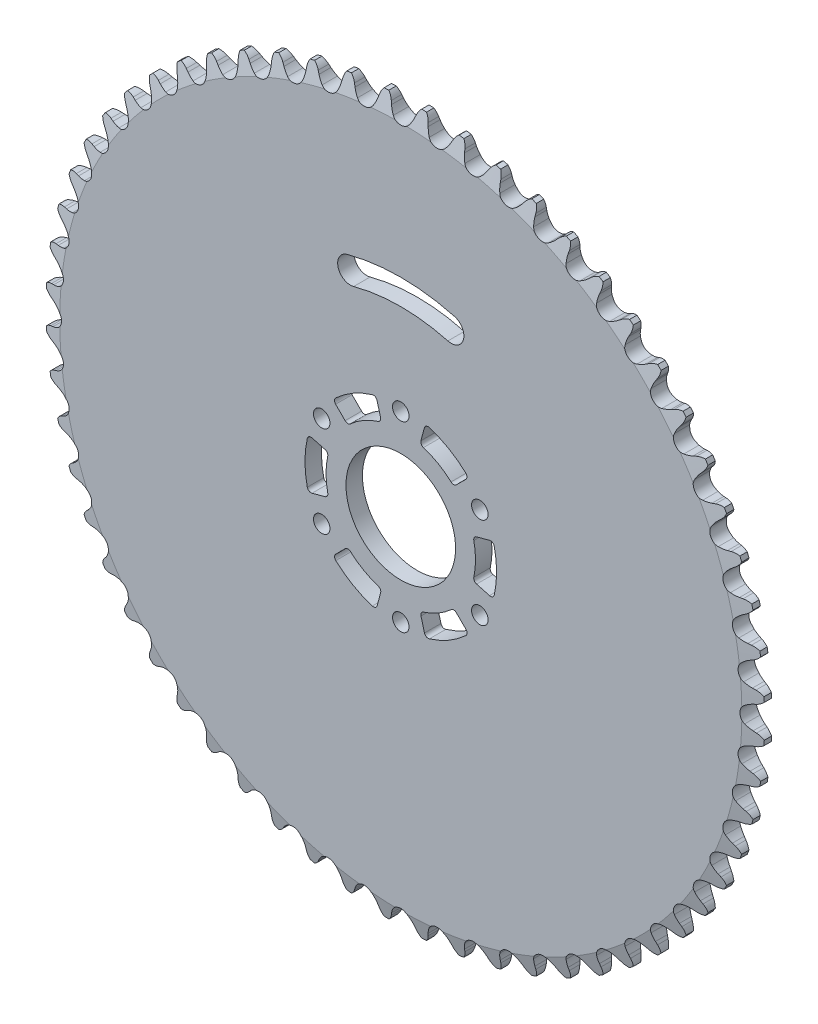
SolidWorks part; units mm, degrees
ref_plane "Front Plane" through (0, 0, 0) normal (0, 0, 1) x (1, 0, 0)
ref_plane "Top Plane" through (0, 0, 0) normal (0, 1, 0) x (1, 0, 0)
ref_plane "Right Plane" through (0, 0, 0) normal (1, 0, 0) x (0, 0, -1)
imported_body "Imported3"
sketch "Sketch1" plane through (0, 0, 2.1463) normal (0, 0, 1) x (1, 0, 0)
  line L0 (-17.7136, 17.6417) -> (-13.8245, 13.7526)
  line L1 (-5.0224, 18.8421) -> (-6.4459, 24.1547)
  arc A0 (-6.4459, 24.1547) -> (-17.7136, 17.6417) centre (0, 0) ccw
  arc A1 (-13.8245, 13.7526) -> (-5.0224, 18.8421) centre (0, 0) cw
extrude "Cut-Extrude1" cut sketch "Sketch1" against normal through all
sketch "Sketch2" plane through (0, 0, 2.1463) normal (0, 0, 1) x (1, 0, 0)
  line L0 (-6.4214, -24.1612) -> (-4.9979, -18.8486)
  line L1 (-13.8065, -13.7706) -> (-17.6956, -17.6597)
  arc A0 (-17.6956, -17.6597) -> (-6.4214, -24.1612) centre (0, 0) ccw
  arc A1 (-4.9979, -18.8486) -> (-13.8065, -13.7706) centre (0, 0) cw
extrude "Cut-Extrude2" cut sketch "Sketch2" against normal through all
sketch "Sketch3" plane through (0, 0, 2.1463) normal (0, 0, 1) x (1, 0, 0)
  line L0 (17.7136, -17.6417) -> (13.8245, -13.7526)
  line L1 (5.0224, -18.8421) -> (6.4459, -24.1547)
  arc A0 (6.4459, -24.1547) -> (17.7136, -17.6417) centre (0, 0) ccw
  arc A1 (13.8245, -13.7526) -> (5.0224, -18.8421) centre (0, 0) cw
extrude "Cut-Extrude3" cut sketch "Sketch3" against normal through all
sketch "Sketch4" plane through (0, 0, 2.1463) normal (0, 0, 1) x (1, 0, 0)
  line L0 (24.1349, 6.5195) -> (18.8223, 5.096)
  line L1 (18.829, -5.0715) -> (24.1416, -6.495)
  arc A0 (24.1416, -6.495) -> (24.1349, 6.5195) centre (0, 0) ccw
  arc A1 (18.8223, 5.096) -> (18.829, -5.0715) centre (0, 0) cw
extrude "Cut-Extrude4" cut sketch "Sketch4" against normal through all
sketch "Sketch5" plane through (0, 0, 2.1463) normal (0, 0, 1) x (1, 0, 0)
  line L0 (6.4214, 24.1612) -> (4.9979, 18.8486)
  line L1 (13.8065, 13.7706) -> (17.6956, 17.6597)
  arc A0 (17.6956, 17.6597) -> (6.4214, 24.1612) centre (0, 0) ccw
  arc A1 (4.9979, 18.8486) -> (13.8065, 13.7706) centre (0, 0) cw
extrude "Cut-Extrude5" cut sketch "Sketch5" against normal through all
sketch "Sketch6" plane through (0, 0, -2.1463) normal (0, 0, -1) x (-1, 0, 0)
  line L0 (24.1416, 6.495) -> (18.829, 5.0715)
  line L1 (18.8223, -5.096) -> (24.1349, -6.5195)
  arc A0 (18.829, 5.0715) -> (18.8223, -5.096) centre (0, 0) cw
  arc A1 (24.1349, -6.5195) -> (24.1416, 6.495) centre (0, 0) ccw
extrude "Cut-Extrude6" cut sketch "Sketch6" against normal through all
hole_wizard "M25 Clearance Hole1" positions "Sketch8" profile "Sketch7" hole size "M25" standard "ANSI Metric"
sketch "Sketch8" plane through (0, 0, -2.1463) normal (0, 0, -1) x (-1, 0, 0)
  point P0 (0, 0)
sketch "Sketch7" plane through (0, 0, -2.1463) normal (1, 0, 0) x (0, 1, 0)
  line L0 (0, 0) -> (0, 4.2926)
  line L1 (0, 4.2926) -> (14.3, 4.2926)
  line L2 (14.3, 4.2926) -> (14.3, 0)
  line L5 (14.3, 0) -> (0, 0)
  line L11 (0, -6.35) -> (0, 107.95) construction
  dimension "Thru Hole Dia." = 28.6
  dimension "Thru Hole Depth" = 4.2926
hole_wizard "M4 Clearance Hole1" positions "Sketch10" profile "Sketch9" hole size "M4" standard "ANSI Metric"
sketch "Sketch10" plane through (0, 0, -2.1463) normal (0, 0, -1) x (-1, 0, 0)
  point P0 (0, -23.8125)
  point P1 (20.6222, -11.9062)
  point P2 (-20.6222, 11.9062)
  point P3 (0, 23.8125)
  point P4 (20.6222, 11.9063)
  point P5 (-20.6222, -11.9063)
sketch "Sketch9" plane through (0, -23.8125, -2.1463) normal (1, 0, 0) x (0, 1, 0)
  line L0 (0, 0) -> (0, 4.2926)
  line L1 (0, 4.2926) -> (2.1526, 4.2926)
  line L2 (2.1526, 4.2926) -> (2.1526, 0)
  line L5 (2.1526, 0) -> (0, 0)
  line L11 (0, -6.35) -> (0, 107.95) construction
  dimension "Thru Hole Dia." = 4.3053
  dimension "Thru Hole Depth" = 4.2926
fillet "Fillet1" radius 1 24 edges at (24.1349, 6.5195, 0) (17.7136, -17.6417, 0) (-6.4214, -24.1612, 0) (-18.8223, -5.096, 0) (18.829, -5.0715, 0) (-24.1416, 6.495, 0) (-4.9979, -18.8486, 0) (-24.1349, -6.5195, 0) (13.8245, -13.7526, 0) (13.8065, 13.7706, 0) (24.1416, -6.495, 0) (4.9979, 18.8486, 0) (18.8223, 5.096, 0) (17.6956, 17.6597, 0) (-13.8065, -13.7706, 0) (6.4214, 24.1612, 0) (-17.6956, -17.6597, 0) (-5.0224, 18.8421, 0) (5.0224, -18.8421, 0) (-13.8245, 13.7526, 0) (6.4459, -24.1547, 0) (-6.4459, 24.1547, 0) (-18.829, 5.0715, 0) (-17.7136, 17.6417, 0)
sketch "Sketch11" plane through (0, 0, 2.1463) normal (0, 0, 1) x (1, 0, 0)
  line L0 (0, 0) -> (0, 50.8) construction
  line L1 (-13.148, 49.069) -> (0, 0) construction
  line L2 (0, 0) -> (13.148, 49.069) construction
  arc A0 (13.148, 49.069) -> (-13.148, 49.069) centre (0, 0) ccw construction
  arc A1 (14.0059, 52.2708) -> (-14.0059, 52.2708) centre (0, 0) ccw
  arc A2 (12.2901, 45.8673) -> (-12.2901, 45.8673) centre (0, 0) ccw
  arc A3 (12.2901, 45.8673) -> (14.0059, 52.2708) centre (13.148, 49.069) ccw
  arc A4 (-14.0059, 52.2708) -> (-12.2901, 45.8673) centre (-13.148, 49.069) ccw
  point P4 (0, 50.8)
  dimension "D1" = 6.6294
  dimension "D2" = 30
  dimension "D3" = 50.8
extrude "Cut-Extrude7" cut sketch "Sketch11" against normal through all
